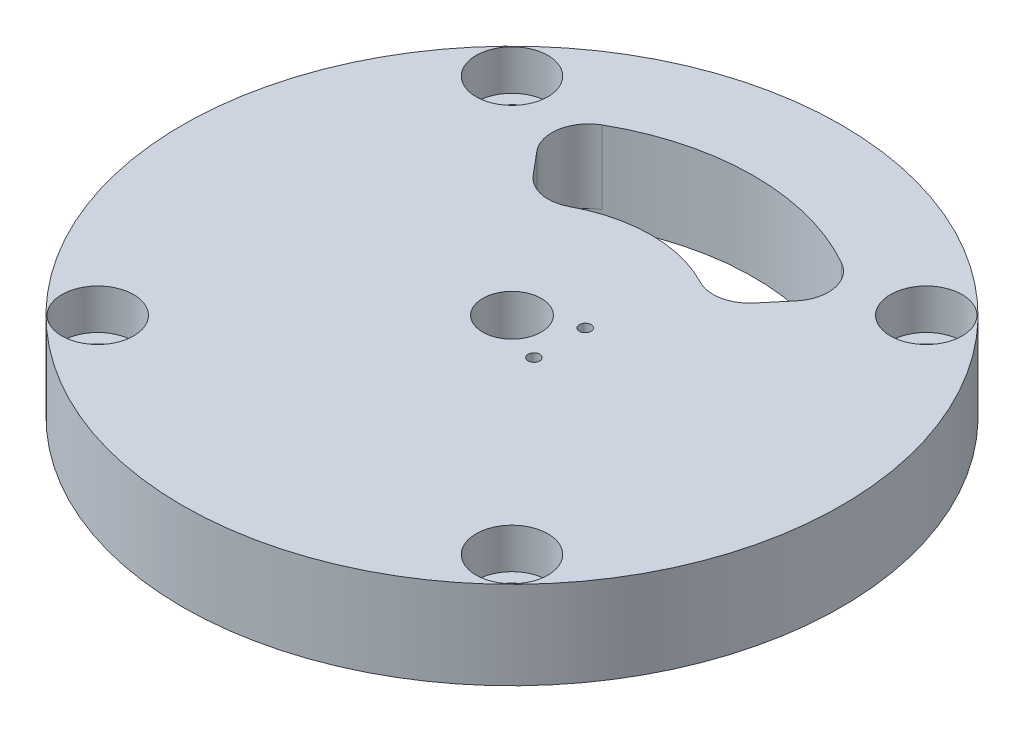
SolidWorks part; units mm, degrees
ref_plane "Front Plane" through (0, 0, 0) normal (0, 0, 1) x (1, 0, 0)
ref_plane "Top Plane" through (0, 0, 0) normal (0, 1, 0) x (1, 0, 0)
ref_plane "Right Plane" through (0, 0, 0) normal (1, 0, 0) x (0, 0, -1)
sketch "Sketch1" plane through (0, 0, 0) normal (0, 1, 0) x (1, 0, 0)
  line L0 (0, 0) -> (0, 49.331) construction
  line L1 (0, 0) -> (28.2843, 28.2843) construction
  line L2 (0, 0) -> (2.5712, 3.0642)
  line L3 (0, 0) -> (-2.5712, 3.0642)
  line L4 (-15.0884, 17.9817) -> (-17.7088, 21.1045)
  line L5 (15.0884, 17.9817) -> (17.7088, 21.1045)
  circle A0 centre (0, 0) radius 45
  circle A1 centre (0, 0) radius 4
  circle A2 centre (28.2843, 28.2843) radius 3
  circle A3 centre (28.2843, -28.2843) radius 3
  circle A4 centre (-28.2843, -28.2843) radius 3
  circle A5 centre (-28.2843, 28.2843) radius 3
  arc A6 (16.3569, 28.661) -> (-16.3569, 28.661) centre (0, 0) ccw
  arc A7 (8.9127, 16.7798) -> (-8.9127, 16.7798) centre (0, 0) ccw
  arc A8 (8.9127, 16.7798) -> (15.0884, 17.9817) centre (11.2582, 21.1956) ccw
  arc A9 (17.7088, 21.1045) -> (16.3569, 28.661) centre (13.8785, 24.3184) ccw
  arc A10 (-17.7088, 21.1045) -> (-16.3569, 28.661) centre (-13.8785, 24.3184) cw
  arc A11 (-8.9127, 16.7798) -> (-15.0884, 17.9817) centre (-11.2582, 21.1956) cw
  point P16 (0, 0)
  point P22 (12.213, 14.5548)
  point P29 (-12.213, 14.5548)
  dimension "D1" = 90
  dimension "D2" = 8
  dimension "D3" = 6
  dimension "D7" = 66
  dimension "D8" = 38
  dimension "D11" = 5
  dimension "D4" = 45
  dimension "D5" = 40
  dimension "D9" = 40
  dimension "D10" = 40
  dimension "D6" = 4
extrude "Boss-Extrude1" add sketch "Sketch1" along normal blind 12 contours A0 A5 A4 A3 A2 A1 A7 A11 L4 A10 A6 A9 L5 A8
sketch "Sketch2" plane through (0, 12, 0) normal (0, 1, 0) x (1, 0, 0)
  circle A0 centre (28.2843, 28.2843) radius 4.9
  circle A1 centre (28.2843, -28.2843) radius 4.9
  circle A2 centre (-28.2843, -28.2843) radius 4.9
  circle A3 centre (-28.2843, 28.2843) radius 4.9
  point P12 (0, 0)
  dimension "D1" = 9.8
  dimension "D2" = 4
extrude "Cut-Extrude4" cut sketch "Sketch2" against normal blind 5.5
hole_wizard "M2x0.4 Tapped Hole1" positions "3DSketch1" profile "Sketch3" tap size "M2x0.4" standard "ANSI Metric"
sketch3d "3DSketch1"
  line L0 (6.5, 12, 3.5) -> (6.5, 12, -3.5) construction
  line L3 (6.5, 12, 0) -> (0, 12, 0) construction
  line L4 (0, 12, 0) -> (0, 0, 0) construction
  line L5 (0, 12, 0) -> (0, 0, 0) construction
  circle A0 centre (0, 12, 0) radius 4 construction
  point P0 (6.5, 12, -3.5)
  point P2 (6.5, 12, 3.5)
  point P15 (0, 16, 0)
  dimension "D1" = 7
  dimension "D2" = 6.5
sketch "Sketch3" plane through (6.5, 12, -3.5) normal (1, 0, 0) x (0, 0, 1)
  line L0 (0, 0) -> (0, 5.6807)
  line L1 (0, 5.6807) -> (0.8, 5.2)
  line L2 (0.8, 5.2) -> (0.8, 0)
  line L5 (0.8, 0) -> (0, 0)
  line L10 (0, 5.6807) -> (-0.8, 5.2) construction
  line L11 (0, -6.35) -> (0, 107.95) construction
  dimension "Tap Drill Dia." = 1.6
  dimension "Tap Drill Depth" = 5.2
  dimension "Drill Angle" = 118
sketch "Sketch4" plane through (0, 0, 0) normal (0, -1, 0) x (1, 0, 0)
  circle A0 centre (0, 0) radius 33
  dimension "D1" = 66
extrude "Cut-Extrude5" cut sketch "Sketch4" against normal blind 2
